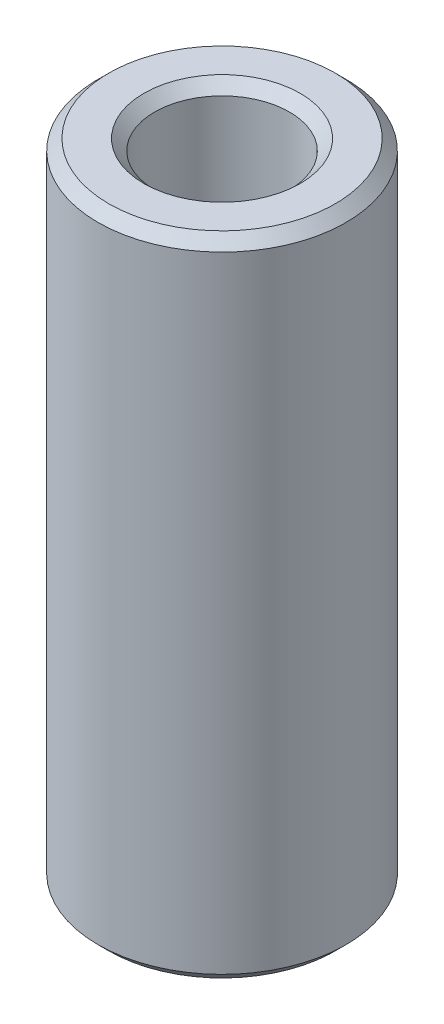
SolidWorks part; units mm, degrees
ref_plane "Face" through (0, 0, 0) normal (0, 0, 1) x (1, 0, 0)
ref_plane "Dessus" through (0, 0, 0) normal (0, 1, 0) x (1, 0, 0)
ref_plane "Droite" through (0, 0, 0) normal (1, 0, 0) x (0, 0, -1)
sketch "Esquisse1" plane through (0, 0, 0) normal (0, 1, 0) x (1, 0, 0)
  circle A0 centre (0, 0) radius 23
  circle A1 centre (0, 0) radius 12.5
  dimension "D1" = 46
  dimension "D2" = 25
extrude "Extrusion1" add sketch "Esquisse1" along normal blind 120
chamfer "Chanfrein1" distance 2 angle 45 4 edges at (0, 0, 12.5) (0, 120, 12.5) (0, 0, 23) (0, 120, 23)
sketch "Esquisse2" plane through (0, 120, 0) normal (0, 1, 0) x (1, 0, 0)
  line L1 (-25.6069, -28.6345) -> (28.0701, -28.6345)
  line L2 (-25.6069, -28.6345) -> (-25.6069, 0)
  line L3 (-25.6069, 0) -> (28.0701, 0)
  line L4 (28.0701, -28.6345) -> (28.0701, 0)
extrude "Enlèv. mat.-Extru.1" [suppressed] cut sketch "Esquisse2" against normal through all
